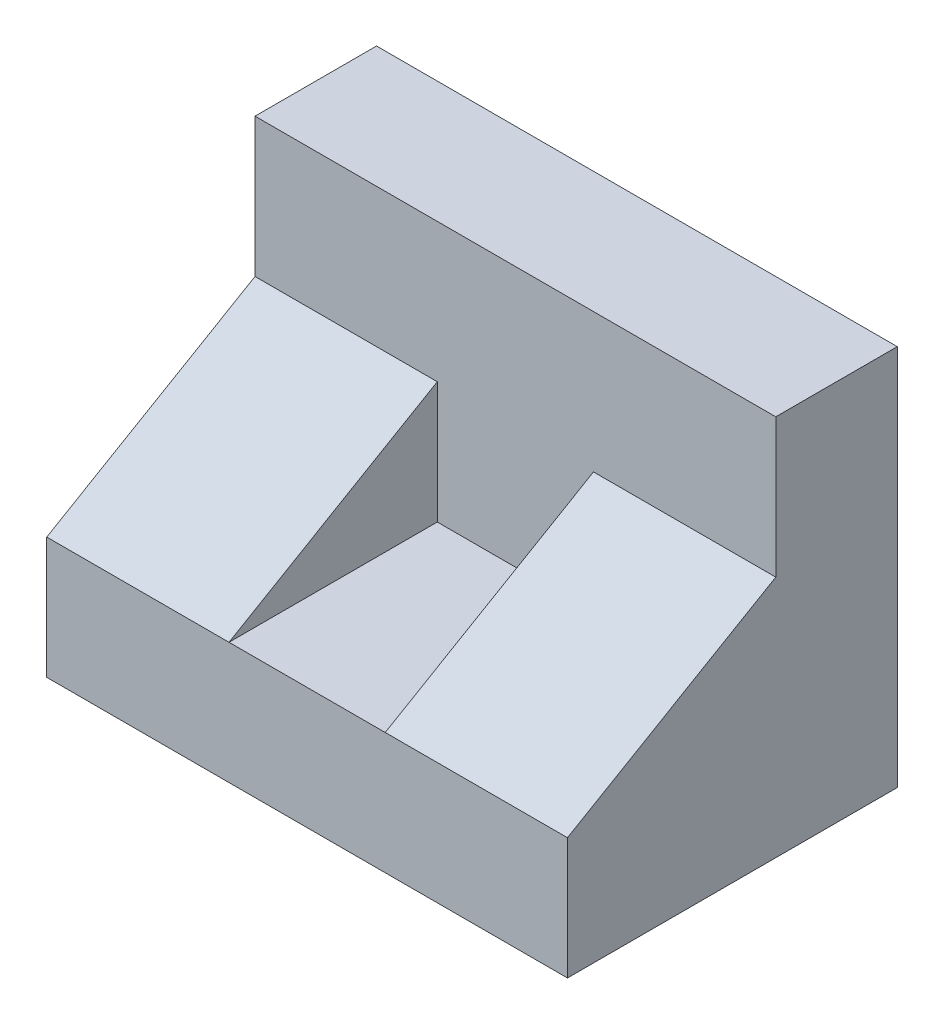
SolidWorks part; units mm, degrees
ref_plane "前视基准面" through (0, 0, 0) normal (0, 0, 1) x (1, 0, 0)
ref_plane "上视基准面" through (0, 0, 0) normal (0, 1, 0) x (1, 0, 0)
ref_plane "右视基准面" through (0, 0, 0) normal (1, 0, 0) x (0, 0, -1)
sketch "草图2" plane through (0, 0, 0) normal (1, 0, 0) x (0, 0, -1)
  line L0 (0, 0) -> (0, -22)
  line L1 (0, -22) -> (-19, -22)
  line L2 (-19, -22) -> (-19, -15)
  line L3 (-19, -15) -> (-7, -8)
  line L4 (-7, -8) -> (-7, 0)
  line L5 (-7, 0) -> (0, 0)
  dimension "D1" = 22
  dimension "D2" = 19
  dimension "D3" = 7
  dimension "D4" = 7
  dimension "D5" = 8
extrude "拉伸1" add sketch "草图2" along normal mid plane 30
sketch "草图3" plane through (0, 0, 0) normal (1, 0, 0) x (0, 0, -1)
  line L0 (-7, -8) -> (-7, -15)
  line L1 (-7, -15) -> (-19, -15)
  line L2 (-7, -8) -> (-19, -15)
extrude "切除-拉伸1" cut sketch "草图3" against normal mid plane 9
